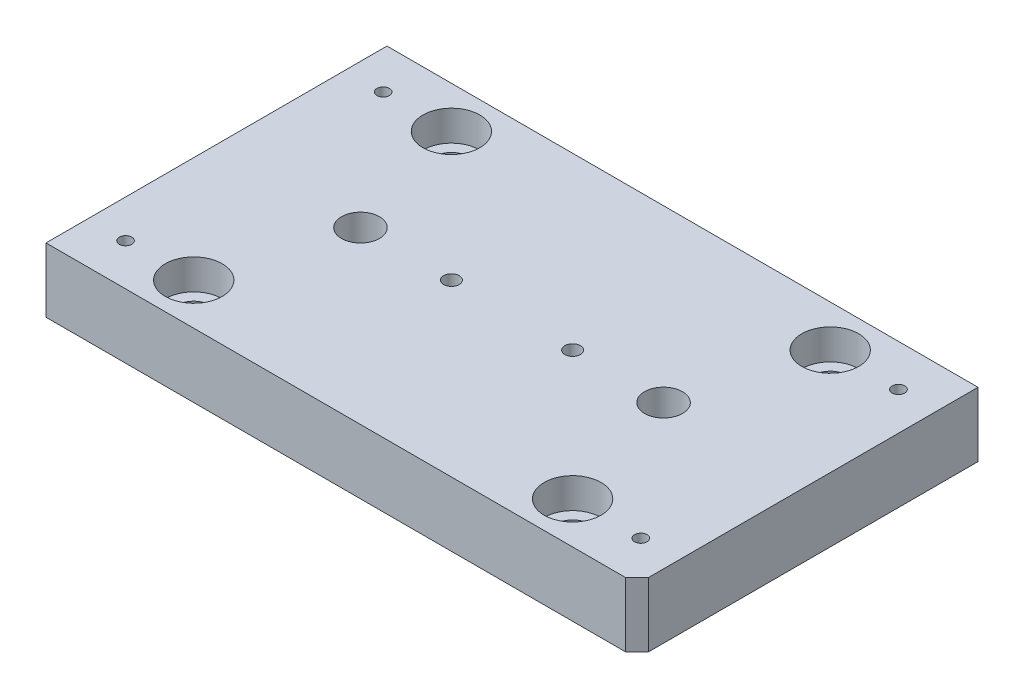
SolidWorks part; units mm, degrees
ref_plane "Plan de face" through (0, 0, 0) normal (0, 0, 1) x (1, 0, 0)
ref_plane "Plan de dessus" through (0, 0, 0) normal (0, 1, 0) x (1, 0, 0)
ref_plane "Plan de droite" through (0, 0, 0) normal (1, 0, 0) x (0, 0, -1)
sketch "Esquisse1" plane through (0, 0, 0) normal (0, 1, 0) x (1, 0, 0)
  line L1 (-78, 45) -> (78, 45)
  line L2 (-78, 45) -> (-78, -45)
  line L3 (-78, -45) -> (78, -45)
  line L4 (78, 45) -> (78, -45)
  point P4 (0, 45)
  point P6 (-78, 0)
  dimension "D1" = 156
  dimension "D2" = 90
extrude "Extrusion1" add sketch "Esquisse1" along normal blind 17
hole_wizard "Trou taraudé M4x0.71" positions "Esquisse3" profile "Esquisse2" tap size "M4x0.7" standard "Ansi Métrique"
sketch "Esquisse3" plane through (0, 17, 0) normal (0, 1, 0) x (-1, 0, 0)
  point P0 (-68, 34)
  point P1 (-68, -34)
  point P3 (68, -34)
  point P5 (68, 34)
  dimension "D1" = 34
  dimension "D2" = 68
  dimension "D3" = 136
  dimension "D4" = 68
sketch "Esquisse2" plane through (68, 17, 34) normal (1, 0, 0) x (0, 0, 1)
  line L0 (0, 0) -> (0, 11.0914)
  line L1 (0, 11.0914) -> (1.65, 10.1)
  line L2 (1.65, 10.1) -> (1.65, 0)
  line L5 (1.65, 0) -> (0, 0)
  line L10 (0, 11.0914) -> (-1.65, 10.1) construction
  line L11 (0, -6.35) -> (0, 107.95) construction
  dimension "Diamètre du trou pour taraudage" = 3.3
  dimension "Profondeur du trou pour taraudage" = 10.1
  dimension "Angle de pointe" = 118
hole_wizard "Chambrage pour vis à tête cylindrique à 6 pans creux (ou vis CHC) M81" positions "Esquisse5" profile "Esquisse4" counterbore size "M8" standard "Ansi Métrique"
sketch "Esquisse5" plane through (0, 17, 0) normal (0, 1, 0) x (-1, 0, 0)
  point P0 (-50, 34)
  point P1 (-50, -34)
  point P3 (50, -34)
  point P5 (50, 34)
  dimension "D1" = 34
  dimension "D2" = 68
  dimension "D3" = 50
  dimension "D4" = 100
sketch "Esquisse4" plane through (50, 17, 34) normal (1, 0, 0) x (0, 0, 1)
  line L0 (0, 0) -> (0, 17)
  line L1 (0, 17) -> (4.5, 17)
  line L3 (4.5, 17) -> (4.5, 8)
  line L4 (4.5, 8) -> (7.5, 8)
  line L5 (7.5, 8) -> (7.5, 0)
  line L7 (7.5, 0) -> (0, 0)
  line L11 (0, -6.35) -> (0, 107.95) construction
  dimension "Diamètre du perçage jusqu'au prochain" = 9
  dimension "Profondeur du perçage jusqu'au prochain" = 17
  dimension "Diamètre du chambrage" = 15
  dimension "Profondeur du chambrage" = 8
sketch "Esquisse6" plane through (0, 17, 0) normal (0, 1, 0) x (-1, 0, 0)
  line L0 (0, 0) -> (-83.2416, 0) construction
  circle A1 centre (-16, 0) radius 2.05
  circle A2 centre (16, 0) radius 2.05
  dimension "D1" = 4.1
  dimension "D4" = 16
  dimension "D5" = 16
extrude "Enlèv. mat.-Extru.1" cut sketch "Esquisse6" against normal through all
sketch "Esquisse8" plane through (0, 0, 0) normal (0, -1, 0) x (1, 0, 0)
  circle A0 centre (16, 0) radius 4.5
  circle A1 centre (-16, 0) radius 4.5
  dimension "D1" = 9
  dimension "D2" = 9
extrude "Enlèv. mat.-Extru.2" cut sketch "Esquisse8" against normal blind 8
sketch "Esquisse9" [suppressed] plane through (0, 0, 0) normal (0, -1, 0) x (1, 0, 0)
  circle A0 centre (0, 0) radius 6.75
  dimension "D1" = 13.5
chamfer "Chanfrein_D" distance 3 angle 45 1 edges at (78, 8.5, 45)
sketch "Esquisse10" plane through (0, 0, 0) normal (0, -1, 0) x (1, 0, 0)
  line L0 (0, 0) -> (100.798, 0) construction
  circle A0 centre (40, 0) radius 5
  circle A1 centre (-40, 0) radius 5
  dimension "D1" = 10
  dimension "D2" = 10
  dimension "D3" = 40
  dimension "D4" = 40
extrude "Enlèv. mat.-Extru.6" cut sketch "Esquisse10" against normal through all
